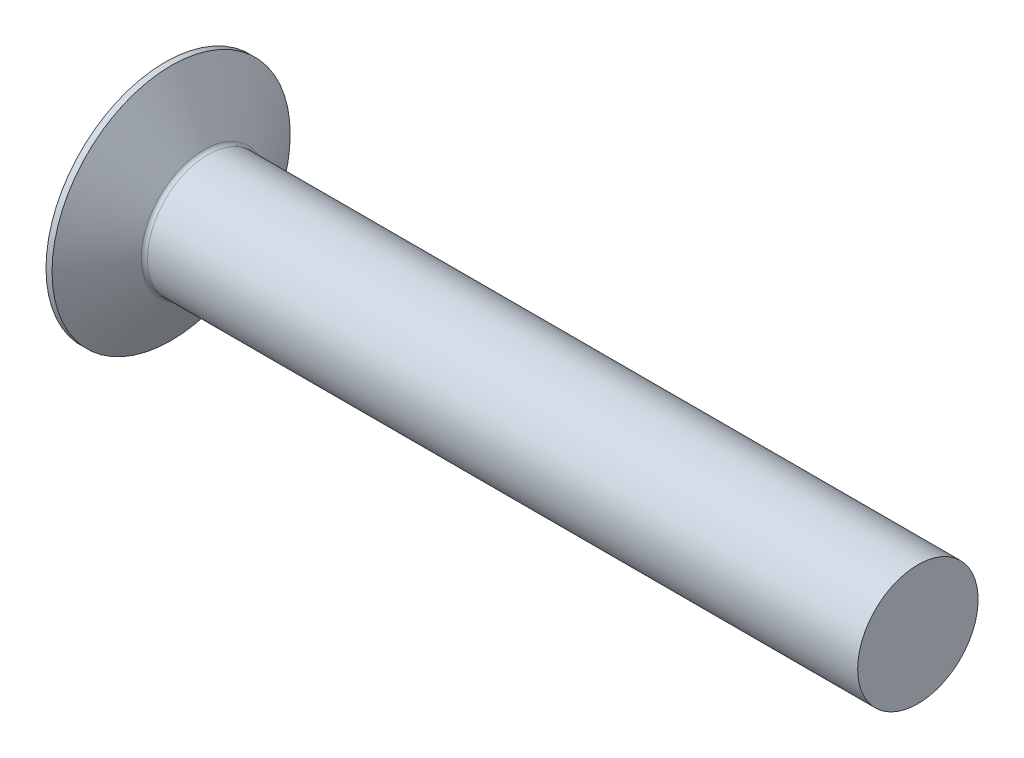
SolidWorks part; units mm, degrees
ref_plane "Front" through (0, 0, 0) normal (0, 0, 1) x (1, 0, 0)
ref_plane "Top" through (0, 0, 0) normal (0, 1, 0) x (1, 0, 0)
ref_plane "Right" through (0, 0, 0) normal (1, 0, 0) x (0, 0, -1)
other "Configuration Table"
sketch "Sketch1" plane through (0, 0, 0) normal (0, 0, 1) x (1, 0, 0)
  line L0 (-69.0696, 0) -> (10.536, 0) construction
  line L1 (50, 0) -> (50, 4)
  line L2 (50, 4) -> (2.8306, 4)
  line L3 (2.5708, 4.15) -> (0.4, 7.91)
  line L4 (0.4, 7.91) -> (0, 7.91)
  line L5 (0, 7.91) -> (0, 0)
  line L6 (50, 0) -> (0, 0)
  arc A0 (2.8306, 4) -> (2.5708, 4.15) centre (2.8306, 4.3) cw
  dimension "r" = 0.3
  dimension "d" = 8
  dimension "l" = 50
  dimension "D3" = 60
  dimension "dk" = 15.82
  dimension "K" = 0.4
revolve "Base-Revolve" add sketch "Sketch1" angle 360 about L0
